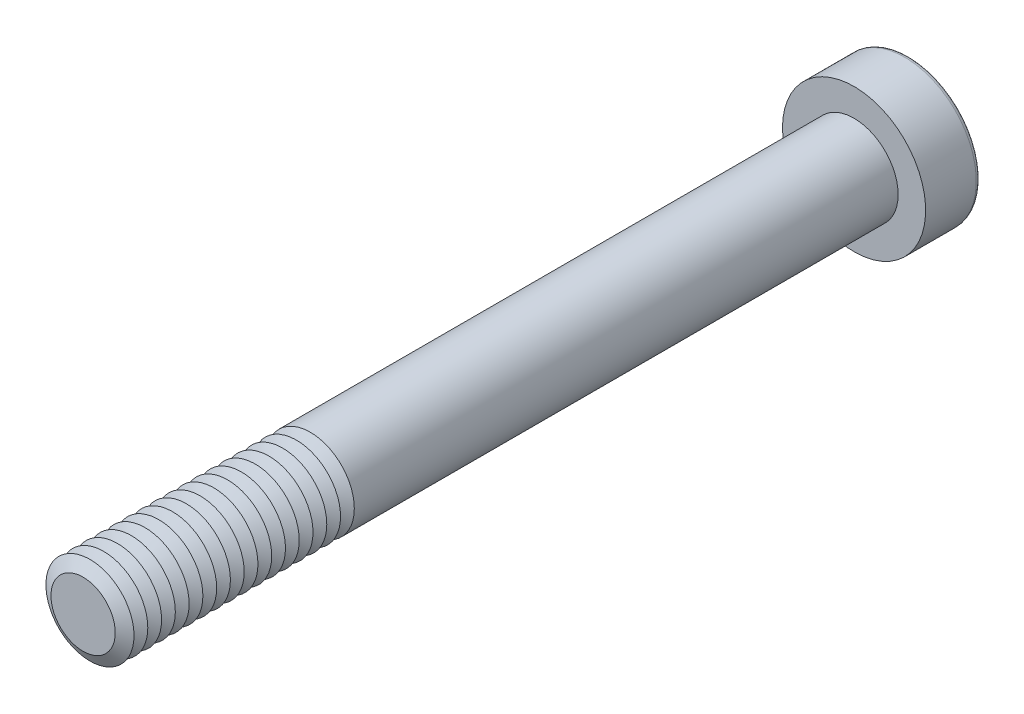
SolidWorks part; units mm, degrees
ref_plane "Front Plane" through (0, 0, 0) normal (0, 0, 1) x (1, 0, 0)
ref_plane "Top Plane" through (0, 0, 0) normal (0, 1, 0) x (1, 0, 0)
ref_plane "Right Plane" through (0, 0, 0) normal (1, 0, 0) x (0, 0, -1)
sketch "Sketch1" plane through (0, 0, 0) normal (0, 0, 1) x (1, 0, 0)
  circle A0 centre (0, 0) radius 4
  dimension "D1" = 8
extrude "Boss-Extrude1" add sketch "Sketch1" along normal blind 70
sketch "Sketch2" plane through (0, 0, 0) normal (0, 0, -1) x (-1, 0, 0)
  circle A0 centre (0, 0) radius 6.5
  dimension "D1" = 13
extrude "Boss-Extrude2" add sketch "Sketch2" along normal blind 5
sketch "Sketch3" plane through (0, 0, -5) normal (0, 0, -1) x (-1, 0, 0)
  line L1 (-1.4434, 2.5) -> (-2.8868, 0)
  line L2 (-2.8868, 0) -> (-1.4434, -2.5)
  line L3 (-1.4434, -2.5) -> (1.4434, -2.5)
  line L4 (1.4434, -2.5) -> (2.8868, 0)
  line L5 (2.8868, 0) -> (1.4434, 2.5)
  line L6 (1.4434, 2.5) -> (-1.4434, 2.5)
  circle A0 centre (0, 0) radius 2.5 construction
  dimension "D1" = 5
extrude "Cut-Extrude1" cut sketch "Sketch3" against normal blind 3.75
fillet "Fillet1" radius 0.4 1 edges at (-6.5, 0, -5)
sketch "Sketch4" plane through (0, 0, -1.25) normal (0, 0, -1) x (-1, 0, 0)
  line L0 (1.4434, -2.5) -> (2.8868, 0) construction
  circle A0 centre (0, 0) radius 2.5
extrude "Cut-Extrude2" cut sketch "Sketch4" against normal through all draft 60
sketch "Sketch5" plane through (0, 0, -5) normal (0, 0, -1) x (-1, 0, 0)
  circle A0 centre (0, 0) radius 2.8868
extrude "Cut-Extrude3" cut sketch "Sketch5" against normal through all draft 75
sketch "Sketch7" plane through (0, 0, 0) normal (1, 0, 0) x (0, 0, -1)
  line L25 (-70, 2.9175) -> (-69.375, 4)
  line L26 (-70, 4) -> (-70, -4) construction
  line L27 (-69.375, 4) -> (-70.625, 4)
  line L28 (-70.625, 4) -> (-70, 2.9175)
  line L29 (0, 4) -> (-70, 4) construction
  dimension "D1" = 1.25
revolve "Cut-Revolve1" cut sketch "Sketch7" angle 360 about axis through (0, 0, 70) along (0, 0, -1)
pattern_linear "LPattern1" count 17 spacing 1.25 along (0, 0, -1) of "Cut-Revolve1"
